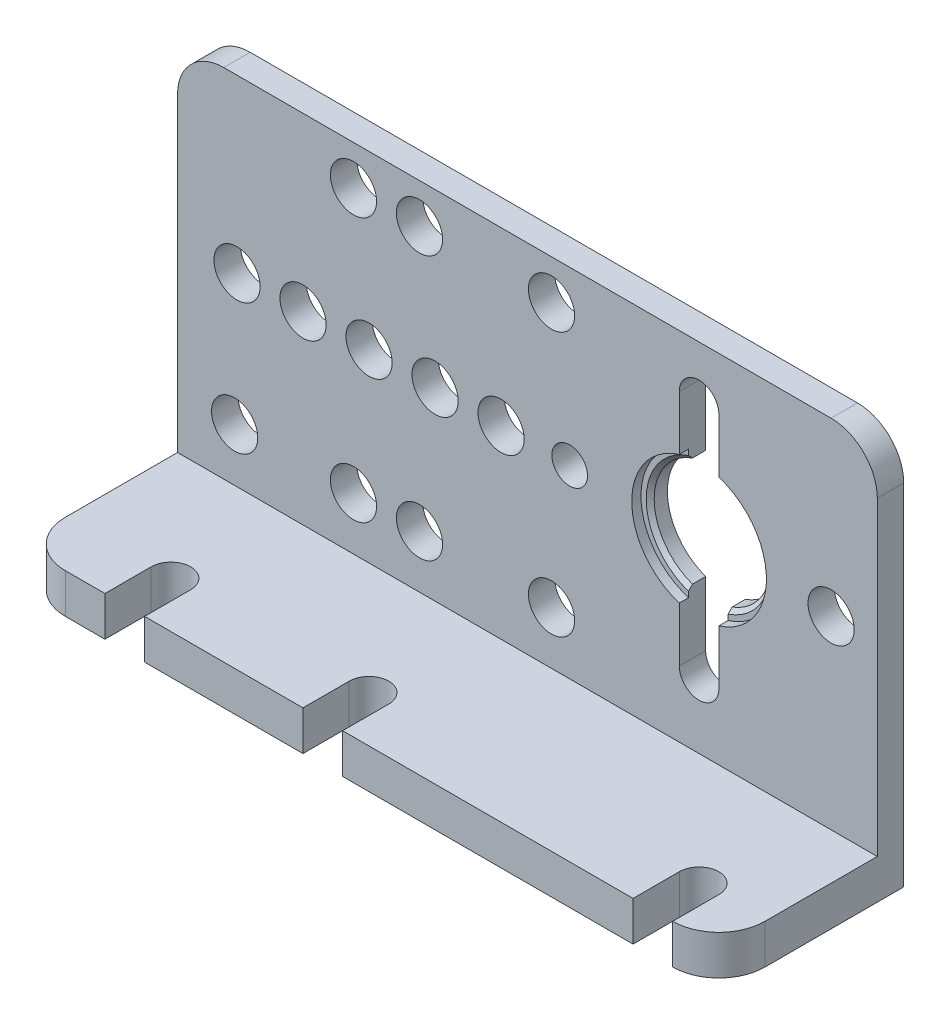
SolidWorks part; units mm, degrees
ref_plane "Plan de face" through (0, 0, 0) normal (0, 0, 1) x (1, 0, 0)
ref_plane "Plan de dessus" through (0, 0, 0) normal (0, 1, 0) x (1, 0, 0)
ref_plane "Plan de droite" through (0, 0, 0) normal (1, 0, 0) x (0, 0, -1)
sketch "Esquisse1" plane through (0, 0, 0) normal (1, 0, 0) x (0, 0, -1)
  line L0 (0, 0) -> (-14, 0)
  line L1 (-14, 0) -> (-14, 3)
  line L2 (-14, 3) -> (-2, 3)
  line L3 (-2, 3) -> (-2, 30)
  line L4 (-2, 30) -> (0, 30)
  line L5 (0, 30) -> (0, 0)
  dimension "D1" = 3
  dimension "D2" = 2
  dimension "D3" = 30
  dimension "D4" = 14
extrude "Extrusion1" add sketch "Esquisse1" along normal mid plane 53
fillet "Congé1" radius 3.5 4 edges at (-26.5, 1.5, 14) (26.5, 1.5, 14) (26.5, 30, 1) (-26.5, 30, 1)
sketch "Esquisse3" plane through (0, 3, 0) normal (0, 1, 0) x (1, 0, 0)
  line L0 (0, 0) -> (0, -14) construction
  line L1 (23, -14) -> (-23, -14) construction
  line L2 (-2, -14) -> (-2, -10.5)
  line L3 (-20, -14) -> (-17, -14)
  line L4 (-20, -14) -> (-20, -10.5)
  line L6 (-17, -14) -> (-17, -10.5)
  line L12 (-26.5, -2) -> (-26.5, -10.5) construction
  line L13 (-5, -14) -> (-2, -14)
  line L14 (-5, -14) -> (-5, -10.5)
  line L15 (23, -14) -> (23, -10.5)
  line L16 (20, -14) -> (23, -14)
  line L17 (20, -14) -> (20, -10.5)
  arc A2 (-20, -10.5) -> (-17, -10.5) centre (-18.5, -10.5) cw
  arc A3 (-5, -10.5) -> (-2, -10.5) centre (-3.5, -10.5) cw
  arc A4 (20, -10.5) -> (23, -10.5) centre (21.5, -10.5) cw
  dimension "D3" = 3.5
  dimension "D1" = 6.5
  dimension "D2" = 3
extrude "Enlèv. mat.-Extru.1" cut sketch "Esquisse3" against normal through all
sketch "Esquisse4" plane through (0, 0, 2) normal (0, 0, 1) x (1, 0, 0)
  line L0 (-26.5, 17) -> (26.5, 17) construction
  line L1 (-26.5, 26.5) -> (-26.5, 3) construction
  line L2 (26.5, 26.5) -> (26.5, 3) construction
  line L3 (23, 30) -> (-23, 30) construction
  line L4 (-26.5, 27) -> (26.5, 27) construction
  line L5 (-26.5, 7) -> (26.5, 7) construction
  line L7 (-5, 0) -> (-17, 0) construction
  line L8 (23, 30) -> (-23, 30) construction
  line L9 (13, 30) -> (13, 0) construction
  line L10 (11.5, 12.8636) -> (11.5, 8)
  line L11 (14.5, 12.8636) -> (14.5, 8)
  line L12 (11.5, 26) -> (11.5, 21.1364)
  line L14 (14.5, 26) -> (14.5, 21.1364)
  circle A0 centre (1.8254, 27) radius 1.75
  arc A1 (7.4595, 30.9347) -> (5.7845, 3.8544) centre (13, 17) ccw construction
  circle A2 centre (-1.9957, 17) radius 1.75
  circle A3 centre (1.8254, 7) radius 1.75
  circle A4 centre (-8.1746, 27) radius 1.75
  circle A5 centre (-8.1746, 7) radius 1.75
  circle A6 centre (-6.9957, 17) radius 1.75
  circle A7 centre (-11.9957, 17) radius 1.75
  circle A8 centre (23, 17) radius 1.75
  circle A9 centre (-16.9957, 17) radius 1.75
  circle A10 centre (-21.9957, 17) radius 1.75
  circle A11 centre (-13.1746, 27) radius 1.75
  circle A12 centre (-13.1746, 7) radius 1.75
  circle A13 centre (-22.1746, 7) radius 1.75
  circle A15 centre (3.2, 17) radius 1.35
  arc A16 (14.5, 26) -> (11.5, 26) centre (13, 26) ccw
  arc A17 (11.5, 8) -> (14.5, 8) centre (13, 8) ccw
  arc A18 (11.5, 21.1364) -> (11.5, 12.8636) centre (13, 17) ccw
  arc A19 (14.5, 12.8636) -> (14.5, 21.1364) centre (13, 17) ccw
  dimension "D4" = 13.5
  dimension "D10" = 2.7
  dimension "D14" = 18
  dimension "D15" = 4.4
  dimension "D5" = 3.5
  dimension "D8" = 10
  dimension "D16" = 14.9957
  dimension "D7" = 3.5
  dimension "D11" = 5
  dimension "D2" = 10
  dimension "D3" = 10
  dimension "D6" = 9.8
  dimension "D9" = 5
  dimension "D12" = 9
  dimension "D13" = 3
  dimension "D17" = 13
extrude "Enlèv. mat.-Extru.2" cut sketch "Esquisse4" against normal through all
sketch "Esquisse5" plane through (0, 0, 2) normal (0, 0, 1) x (1, 0, 0)
  circle A0 centre (13, 17) radius 5.1
  dimension "D1" = 10.2
extrude "Enlèv. mat.-Extru.3" cut sketch "Esquisse5" against normal blind 0.7
chamfer "Chanfrein1" distance 0.3 angle 45 2 edges at (17.4, 17, 1.3) (8.6, 17, 1.3)
